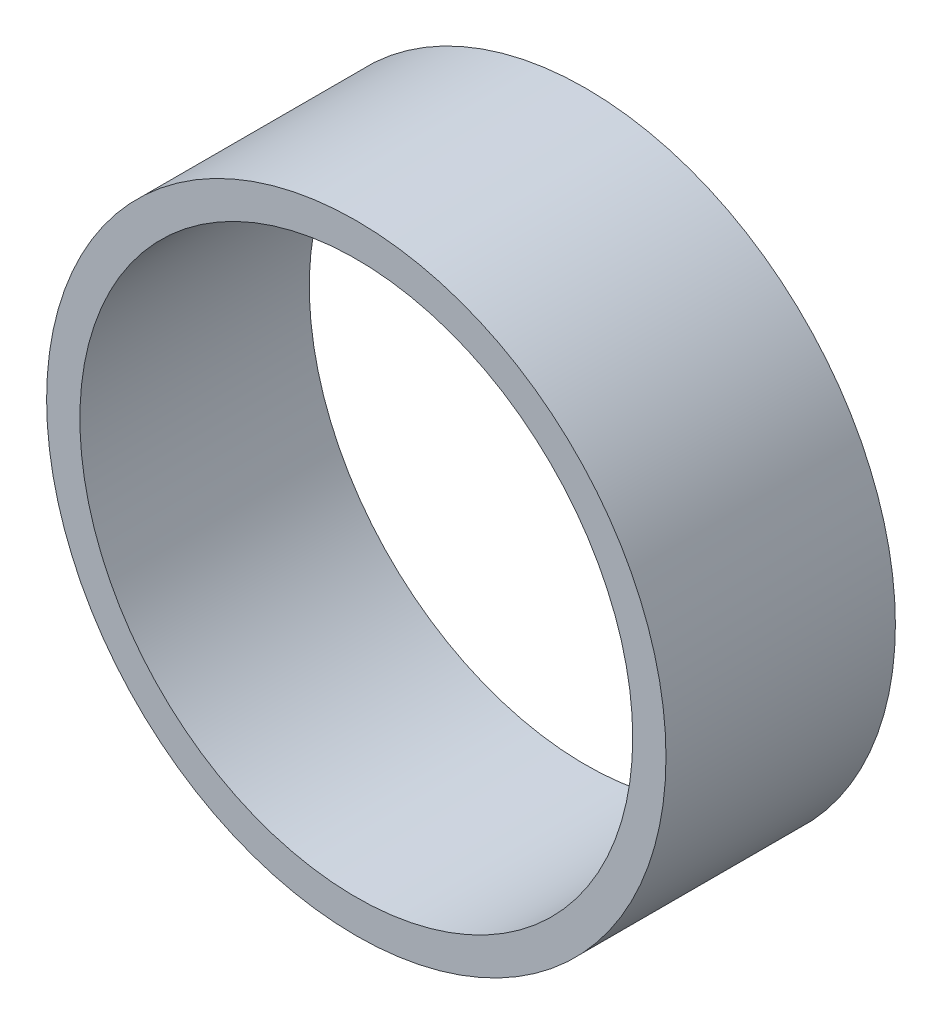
SolidWorks part; units mm, degrees
ref_plane "Face" through (0, 0, 0) normal (0, 0, 1) x (1, 0, 0)
ref_plane "Dessus" through (0, 0, 0) normal (0, 1, 0) x (1, 0, 0)
ref_plane "Droite" through (0, 0, 0) normal (1, 0, 0) x (0, 0, -1)
sketch "Esquisse1" plane through (0, 0, 0) normal (0, 0, 1) x (1, 0, 0)
  circle A0 centre (0, 0) radius 24.1
  circle A1 centre (0, 0) radius 27
  dimension "D1" = 48.2
  dimension "D2" = 54
extrude "Extrusion1" add sketch "Esquisse1" along normal blind 20
